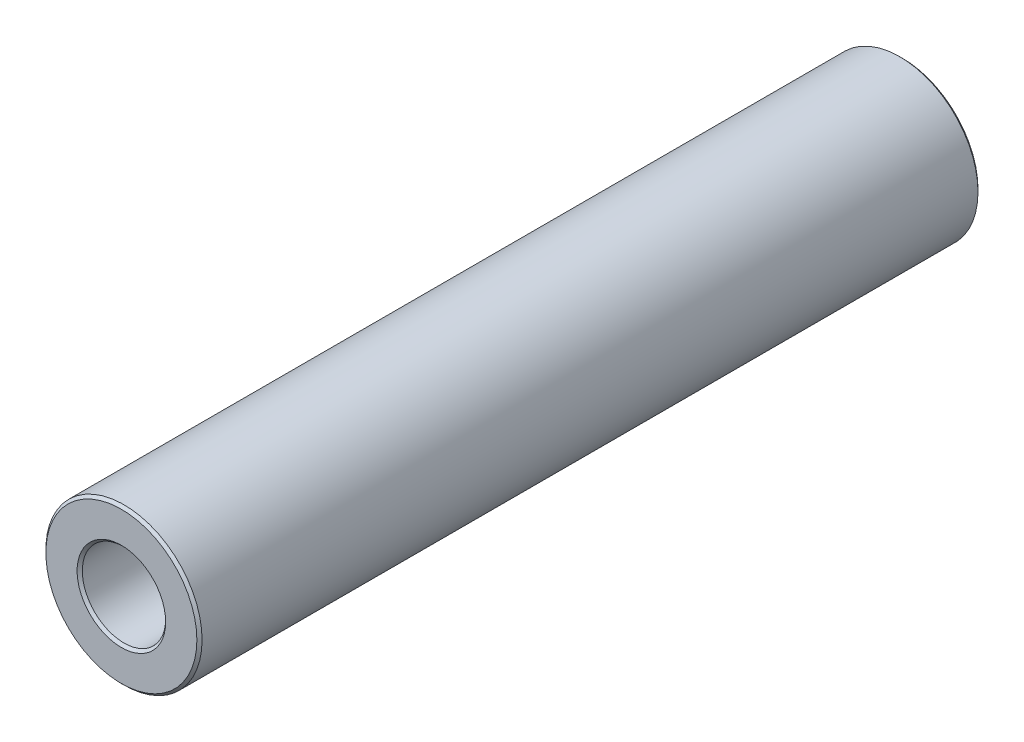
SolidWorks part; units mm, degrees
ref_plane "Front Plane" through (0, 0, 0) normal (0, 0, 1) x (1, 0, 0)
ref_plane "Top Plane" through (0, 0, 0) normal (0, 1, 0) x (1, 0, 0)
ref_plane "Right Plane" through (0, 0, 0) normal (1, 0, 0) x (0, 0, -1)
sketch "Sketch1" plane through (0, 0, 0) normal (0, 0, 1) x (1, 0, 0)
  circle A0 centre (0, 0) radius 3
  circle A1 centre (0, 0) radius 1.6
  dimension "D1" = 6
  dimension "D2" = 3.2
extrude "Boss-Extrude2" add sketch "Sketch1" along normal mid plane 30
chamfer "Chamfer3" distance 0.1 angle 45 4 edges at (3, 0, 15) (3, 0, -15) (1.6, 0, -15) (1.6, 0, 15)
